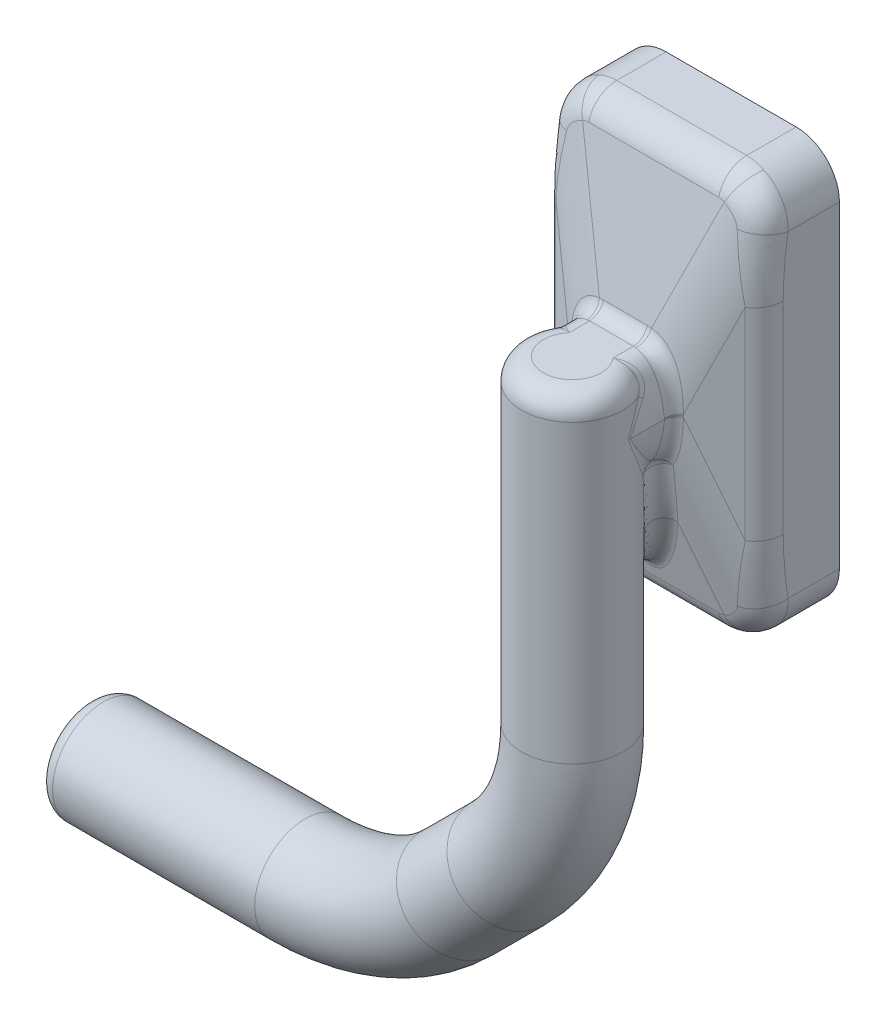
SolidWorks part; units mm, degrees
ref_plane "Спереди" through (0, 0, 0) normal (0, 0, 1) x (1, 0, 0)
ref_plane "Сверху" through (0, 0, 0) normal (0, 1, 0) x (1, 0, 0)
ref_plane "Справа" through (0, 0, 0) normal (1, 0, 0) x (0, 0, -1)
sketch "Sketch1" plane through (0, 0, 0) normal (0, 0, 1) x (1, 0, 0)
  line L1 (-75, 140) -> (75, 140)
  line L2 (-75, 140) -> (-75, -140)
  line L3 (-75, -140) -> (75, -140)
  line L4 (75, 140) -> (75, -140)
  line L5 (-75, 140) -> (75, -140) construction
  line L6 (-75, -140) -> (75, 140) construction
  point P0 (0, 0)
  dimension "D1" = 150
  dimension "D2" = 280
extrude "Boss-Extrude1" add sketch "Sketch1" along normal blind 75
sketch "Sketch2" plane through (75, 0, 0) normal (1, 0, 0) x (0, 0, -1)
  line L0 (-50, -140) -> (-50, 140) construction
  line L1 (-75, -140) -> (0, -140) construction
  line L2 (-75, 140) -> (0, 140) construction
  line L3 (-50, 140) -> (-75, 35)
  line L4 (-75, -140) -> (-75, 140) construction
  line L5 (-75, 35) -> (-75, -35)
  line L6 (-75, -35) -> (-50, -140)
  line L7 (0, -140) -> (0, 140) construction
  line L8 (-75, 0) -> (0, 0) construction
  dimension "D1" = 50
  dimension "D2" = 70
extrude "Cut-Extrude1" cut sketch "Sketch2" against normal through all and the other way through all flip side to cut
sketch "Sketch3" plane through (0, 140, 0) normal (0, 1, 0) x (1, 0, 0)
  line L0 (-75, -50) -> (-35, -75)
  line L1 (-75, -75) -> (75, -75) construction
  line L2 (-35, -75) -> (35, -75)
  line L3 (35, -75) -> (75, -50)
  dimension "D1" = 70
extrude "Cut-Extrude3" cut sketch "Sketch3" against normal through all and the other way through all flip side to cut
fillet "Fillet1" radius 30 4 edges at (-75, -140, 25) (75, -140, 25) (-75, 140, 25) (75, 140, 25)
fillet "Fillet2" radius 60 4 edges at (-52.4646, -80.8446, 64.0846) (52.4646, -80.8446, 64.0846) (52.4646, 80.8446, 64.0846) (-52.4646, 80.8446, 64.0846)
sketch "Sketch4" plane through (0, 0, 0) normal (0, 0, -1) x (-1, 0, 0)
  line L8 (-45, -120) -> (45, -120)
  line L9 (55, -110) -> (55, 110)
  line L10 (45, 120) -> (-45, 120)
  line L11 (-55, 110) -> (-55, -110)
  line L12 (-45, -120) -> (45, -120)
  line L13 (55, -110) -> (55, 110)
  line L14 (45, 120) -> (-45, 120)
  line L15 (-55, 110) -> (-55, -110)
  arc A8 (45, -120) -> (55, -110) centre (45, -110) ccw
  arc A9 (55, 110) -> (45, 120) centre (45, 110) ccw
  arc A10 (-45, 120) -> (-55, 110) centre (-45, 110) ccw
  arc A11 (-55, -110) -> (-45, -120) centre (-45, -110) ccw
  arc A12 (45, -120) -> (55, -110) centre (45, -110) ccw
  arc A13 (55, 110) -> (45, 120) centre (45, 110) ccw
  arc A14 (-45, 120) -> (-55, 110) centre (-45, 110) ccw
  arc A15 (-55, -110) -> (-45, -120) centre (-45, -110) ccw
  dimension "D1" = 20
extrude "Cut-Extrude4" cut sketch "Sketch4" against normal blind 25
fillet "Fillet3" radius 20 8 edges at (55, 0, 25) (52.0711, 117.0711, 25) (0, 120, 25) (-52.0711, 117.0711, 25) (-55, 0, 25) (-52.0711, -117.0711, 25) (0, -120, 25) (52.0711, -117.0711, 25)
fillet "Fillet4" radius 20 16 edges at (49.8555, 139.6045, 50.0942) (69.9184, 126.7055, 50.2167) (75, 102.2268, 49.9079) (75, 0, 50) (75, -102.2268, 49.9079) (68.7457, -128.3341, 50.3433) (49.8555, -139.6045, 50.0942) (0, -140, 50) (-49.8555, -139.6045, 50.0942) (-69.9184, -126.7055, 50.2167) (-75, -102.2268, 49.9079) (-75, 0, 50) (-75, 102.2268, 49.9079) (-68.7457, 128.3341, 50.3433) (-49.8555, 139.6045, 50.0942) (0, 140, 50)
ref_plane "Plane1" through (0, 0, 110) normal (0, 0, 1) x (1, 0, 0)
sketch "Sketch6" plane through (0, 0, 110) normal (0, 0, 1) x (1, 0, 0)
  line L0 (0, 75.4253) -> (0, -370) construction
  line L1 (0, -370) -> (-215, -370) construction
  line L2 (45, -140) -> (-45, -140) construction
  line L3 (-75, -69.9761) -> (-75, 69.9761) construction
  line L4 (-215, -370) -> (-335, -370) construction
  line L5 (-335, -370) -> (-185, -370)
  line L6 (-78.934, -326.066) -> (-43.934, -291.066)
  line L7 (0, -185) -> (0, 35)
  line L8 (-15.1816, 35) -> (15.1816, 35) construction
  arc A0 (-43.934, -291.066) -> (0, -185) centre (-150, -185) ccw
  arc A1 (-185, -370) -> (-78.934, -326.066) centre (-185, -220) ccw
  point P16 (0, -247.132)
  point P19 (-122.868, -370)
  dimension "D4" = 150
  dimension "D1" = 230
  dimension "D2" = 140
  dimension "D3" = 120
  dimension "D5" = 45
  dimension "D6" = 30
ref_plane "Plane2" through (0, 35, 110) normal (0, 1, 0) x (1, 0, 0)
sketch "Sketch7" plane through (0, 35, 110) normal (0, 1, 0) x (1, 0, 0)
  circle A0 centre (0, 0) radius 35
  dimension "D1" = 70
sweep "Sweep1" add profiles "Sketch7" path "Sketch6"
sketch "Sketch8" plane through (0, 0, 75) normal (0, 0, 1) x (1, 0, 0)
  line L2 (15.1816, 35) -> (-15.1816, 35)
  line L3 (-15.1816, -35) -> (15.1816, -35)
  line L4 (15.1816, 35) -> (-15.1816, 35)
  line L5 (-15.1816, -35) -> (15.1816, -35)
  ellipse E4 centre (-78.2078, -224.0444) end of major axis (20.1398, 34.1179) minor radius 60 (34.6832, 0) -> (15.1816, 35) ccw
  ellipse E5 centre (78.2078, -224.0444) end of major axis (-20.1398, 34.1179) minor radius 60 (-15.1816, 35) -> (-34.6832, 0) ccw
  ellipse E6 centre (78.2078, 224.0444) end of major axis (-20.1398, -34.1179) minor radius 60 (-34.6832, 0) -> (-15.1816, -35) ccw
  ellipse E7 centre (-78.2078, 224.0444) end of major axis (-176.5553, 482.2067) minor radius 60 (15.1816, -35) -> (34.6832, 0) ccw
  ellipse E8 centre (-78.2078, -224.0444) end of major axis (20.1398, 34.1179) minor radius 60 (34.6832, 0) -> (15.1816, 35) ccw
  ellipse E9 centre (78.2078, -224.0444) end of major axis (176.5553, -482.2067) minor radius 60 (-15.1816, 35) -> (-34.6832, 0) ccw
  ellipse E10 centre (78.2078, 224.0444) end of major axis (-20.1398, -34.1179) minor radius 60 (-34.6832, 0) -> (-15.1816, -35) ccw
  ellipse E11 centre (-78.2078, 224.0444) end of major axis (-176.5553, 482.2067) minor radius 60 (15.1816, -35) -> (34.6832, 0) ccw
  dimension "D1" = 0
extrude "Boss-Extrude2" add sketch "Sketch8" along normal up to surface (1.9166 mm away)
fillet "Fillet5" radius 15 1 edges
fillet "Fillet6" radius 10 7 edges at (-28.6033, -26.097, 75) (-28.6033, 26.097, 75) (28.6033, -26.097, 75) (28.6033, 26.097, 75)
fillet "Fillet7" radius 10 6 edges at (24.9743, 30.9675, 92.9613) (30.5264, -21.9603, 92.8787) (33.655, 9.6152, 100.3906) (-30.22, -22.7253, 92.3435) (-24.9743, 30.9675, 92.9613)
fillet "Fillet8" radius 10 1 edges at (-335, -335, 110)
ref_plane "Plane3" through (-215, -370, 110) normal (1, 0, 0) x (0, 0, -1)
ref_plane "Plane4" through (0, -370, 0) normal (0, 1, 0) x (1, 0, 0)
